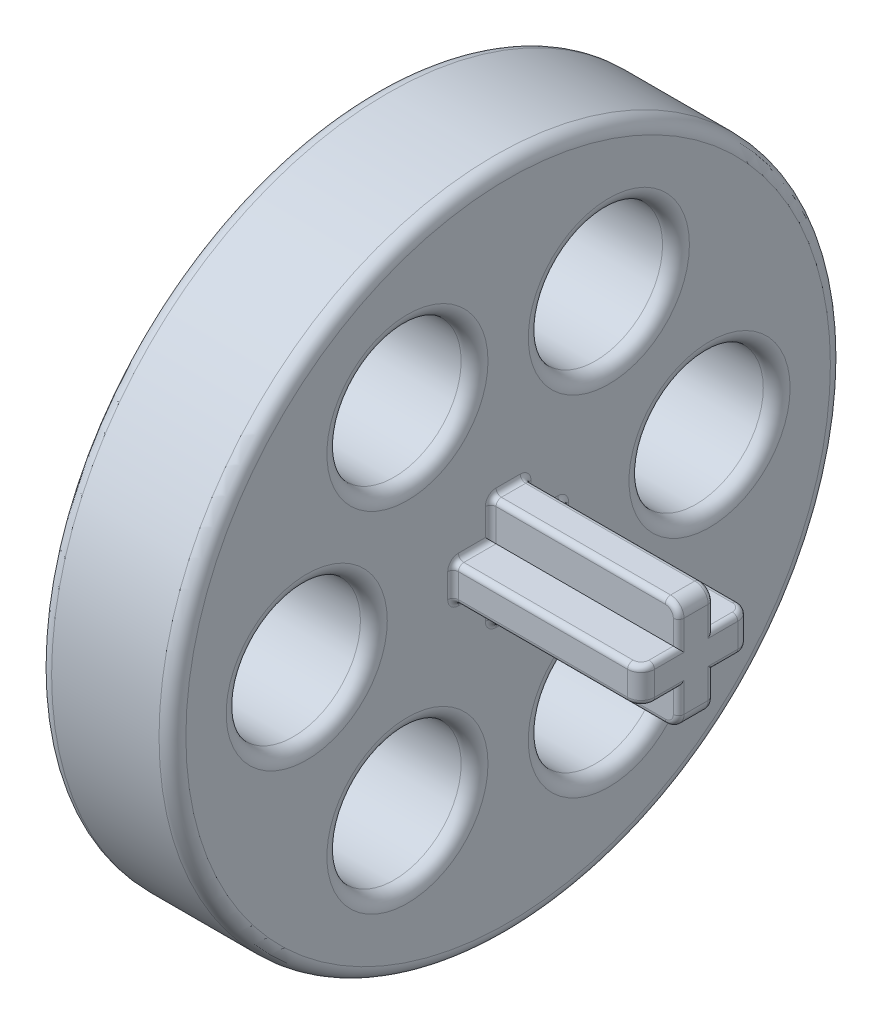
SolidWorks part; units mm, degrees
ref_plane "Front Plane" through (0, 0, 0) normal (0, 0, 1) x (1, 0, 0)
ref_plane "Top Plane" through (0, 0, 0) normal (0, 1, 0) x (1, 0, 0)
ref_plane "Right Plane" through (0, 0, 0) normal (1, 0, 0) x (0, 0, -1)
sketch "Sketch1" plane through (0, 0, 0) normal (1, 0, 0) x (0, 0, -1)
  circle A0 centre (0, 0) radius 12.5
  circle A3 centre (7.5, 0) radius 2.5
  circle A4 centre (3.75, -6.4952) radius 2.5
  circle A5 centre (-3.75, -6.4952) radius 2.5
  circle A6 centre (-7.5, 0) radius 2.5
  circle A7 centre (-3.75, 6.4952) radius 2.5
  circle A8 centre (3.75, 6.4952) radius 2.5
  dimension "D4" = 5
  dimension "D7" = 25
  dimension "D5" = 7.5
  dimension "D6" = 6
extrude "body extrude" add sketch "Sketch1" along normal blind 5
sketch "Sketch3" plane through (0, 0, 0) normal (-1, 0, 0) x (0, 0, 1)
  line L0 (-1.6583, 2.5) -> (1.6583, 2.5) construction
  line L1 (0, -3) -> (0, 2.5) construction
  line L2 (-1.7321, 2.75) -> (1.7321, 2.75)
  arc A0 (-1.6583, 2.5) -> (1.6583, 2.5) centre (0, 0) ccw construction
  arc A1 (-1.7321, 2.75) -> (1.7321, 2.75) centre (0, 0) ccw
  point P1 (0, -3)
  point P2 (-1.6583, 2.5)
  point P3 (1.6583, 2.5)
  dimension "D1" = 6
  dimension "D2" = 5.5
  dimension "D3" = 0.25
extrude "motorhole" [suppressed] cut sketch "Sketch3" against normal blind 3
sketch "Sketch4" plane through (5, 0, 0) normal (1, 0, 0) x (0, 0, -1)
  line L0 (-0.9, 2.3) -> (0.9, 2.3) construction
  line L1 (0.9, 2.3) -> (0.9, 0.9) construction
  line L2 (0.9, 0.9) -> (2.3, 0.9) construction
  line L3 (2.3, 0.9) -> (2.3, -0.9) construction
  line L4 (2.3, -0.9) -> (0.9, -0.9) construction
  line L5 (0.9, -0.9) -> (0.9, -2.3) construction
  line L6 (0.9, -2.3) -> (-0.9, -2.3) construction
  line L7 (-0.9, -2.3) -> (-0.9, -0.9) construction
  line L8 (-0.9, -0.9) -> (-2.3, -0.9) construction
  line L9 (-2.3, -0.9) -> (-2.3, 0.9) construction
  line L10 (-2.3, 0.9) -> (-0.9, 0.9) construction
  line L11 (-0.9, 0.9) -> (-0.9, 2.3) construction
  line L12 (-0.65, 2.05) -> (0.65, 2.05)
  line L13 (0.65, 2.05) -> (0.65, 0.65)
  line L14 (0.65, 0.65) -> (2.05, 0.65)
  line L15 (2.05, 0.65) -> (2.05, -0.65)
  line L16 (2.05, -0.65) -> (0.65, -0.65)
  line L17 (0.65, -0.65) -> (0.65, -2.05)
  line L18 (0.65, -2.05) -> (-0.65, -2.05)
  line L19 (-0.65, -2.05) -> (-0.65, -0.65)
  line L20 (-0.65, -0.65) -> (-2.05, -0.65)
  line L21 (-2.05, -0.65) -> (-2.05, 0.65)
  line L22 (-2.05, 0.65) -> (-0.65, 0.65)
  line L23 (-0.65, 0.65) -> (-0.65, 2.05)
  dimension "D1" = 1.8
  dimension "D2" = 4.6
  dimension "D3" = 4.6
  dimension "D4" = 1.4
  dimension "D5" = 0.9
  dimension "D6" = 0.9
  dimension "D7" = 1.4
  dimension "D8" = 0.25
extrude "legoaxlehole" add sketch "Sketch4" along normal blind 7
fillet "Fillet-axle1" radius 0.2 8 edges at (8.5, -0.65, 2.05) (8.5, 0.65, 2.05) (8.5, 2.05, 0.65) (8.5, 2.05, -0.65) (8.5, 0.65, -2.05) (8.5, -0.65, -2.05) (8.5, -2.05, -0.65) (8.5, -2.05, 0.65)
fillet "Fillet-axle2" radius 0.5 4 edges at (12, 2.05, 0) (12, 0, 2.05) (12, 0, -2.05) (12, -2.05, 0)
fillet "Fillet-axle3" radius 0.2 36 edges at (5, 1.25, -0.65) (5, 1.9914, -0.5914) (5, 1.25, 0.65) (5, 1.9914, 0.5914) (5, -0.65, -1.25) (5, -0.5914, -1.9914) (5, 0.65, -1.25) (5, 0.5914, -1.9914) (5, -1.25, 0.65) (5, -1.9914, 0.5914) (5, -1.25, -0.65) (5, -1.9914, -0.5914) (5, 0.65, 1.25) (5, 0.5914, 1.9914) (5, -0.65, 1.25) (5, -0.5914, 1.9914) (12, 1.1, 0.65) (11.9743, 1.7081, 0.65) (5, 2.05, 0) (11.9743, 1.7081, -0.65) (12, 1.1, -0.65) (11.9743, 0.65, -1.7081) (5, 0, -2.05) (11.9743, -0.65, -1.7081) (11.9743, -1.7081, -0.65) (5, -2.05, 0) (11.9743, -1.7081, 0.65) (11.9743, -0.65, 1.7081) (5, 0, 2.05) (11.9743, 0.65, 1.7081) (12, 0.65, 1.1) (12, -0.65, 1.1) (12, -1.1, 0.65) (12, -1.1, -0.65) (12, -0.65, -1.1) (12, 0.65, -1.1)
sketch "Sketch7" plane through (0, 0, 0) normal (0, 1, 0) x (1, 0, 0)
  line L0 (0, 0) -> (8, 0) construction
  line L1 (8, -3.2) -> (8, 0)
  line L3 (8, 0) -> (11.2, 0)
  arc A0 (11.2, 0) -> (8, -3.2) centre (8, 0) cw
  dimension "D2" = 3.2
  dimension "D1" = 8
revolve "3D print arc" [suppressed] cut sketch "Sketch7" angle 360 about L0
fillet "3D print fillet" radius 0.5 14 edges at (5, 6.4952, -6.25) (5, 0, 5) (5, -6.4952, -6.25) (5, 0, -12.5) (5, 0, -10) (5, -6.4952, 1.25) (5, 6.4952, 1.25) (0, 6.4952, -6.25) (0, 6.4952, 1.25) (0, 0, 5) (0, -6.4952, 1.25) (0, -6.4952, -6.25) (0, 0, -10) (0, 0, -12.5)
